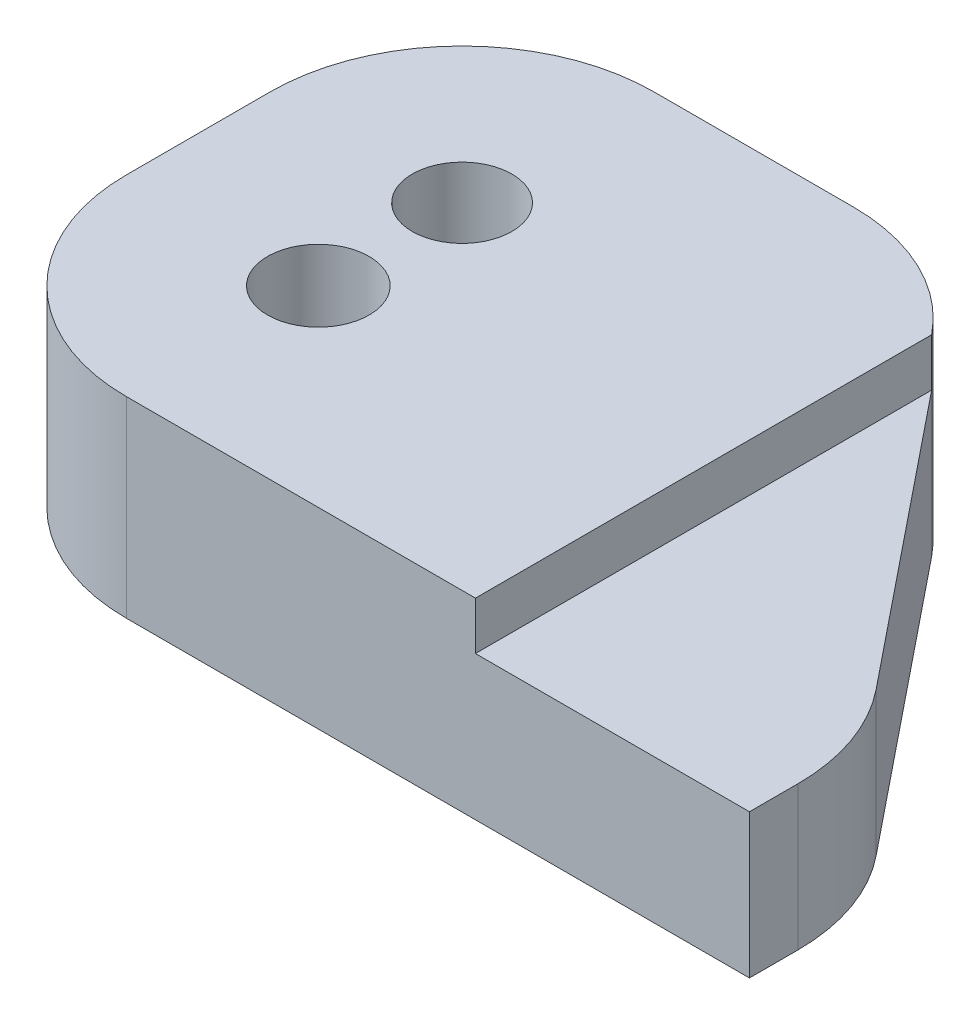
SolidWorks part; units mm, degrees
ref_plane "Front Plane" through (0, 0, 0) normal (0, 0, 1) x (1, 0, 0)
ref_plane "Top Plane" through (0, 0, 0) normal (0, 1, 0) x (1, 0, 0)
ref_plane "Right Plane" through (0, 0, 0) normal (1, 0, 0) x (0, 0, -1)
sketch "Sketch1" plane through (0, 0, 0) normal (0, 1, 0) x (1, 0, 0)
  line L0 (10.0403, 34.9076) -> (53.9179, -19.499)
  line L1 (-53.9179, -34.9076) -> (53.9179, -34.9076)
  line L2 (-53.9179, -34.9076) -> (-53.9179, 34.9076)
  line L3 (-53.9179, 34.9076) -> (10.0403, 34.9076)
  line L4 (53.9179, -34.9076) -> (53.9179, -19.499)
  line L5 (-53.9179, -34.9076) -> (53.9179, 34.9076) construction
  line L6 (-53.9179, 34.9076) -> (53.9179, -34.9076) construction
  line L7 (10.0403, 34.9076) -> (53.9179, 34.9076) construction
  line L8 (53.9179, 34.9076) -> (53.9179, -19.499) construction
  point P0 (0, 0)
extrude "Boss-Extrude1" add sketch "Sketch1" along normal blind 19.05
fillet "Fillet1" radius 25.4 4 edges at (-53.9179, 9.525, 34.9076) (-53.9179, 9.525, -34.9076) (10.0403, 9.525, -34.9076) (53.9179, 9.525, 19.499)
sketch "Sketch3" plane through (0, 19.05, 0) normal (0, 1, 0) x (1, 0, 0)
  line L0 (17.6653, 25.4528) -> (17.6653, -34.9076)
  line L5 (-53.9179, 9.5076) -> (-53.9179, -9.5076)
  line L6 (-28.5179, -34.9076) -> (53.9179, -34.9076)
  line L7 (53.9179, -34.9076) -> (53.9179, -28.4651)
  line L8 (48.2894, -12.5199) -> (17.6653, 25.4528)
  line L9 (-2.1061, 34.9076) -> (-28.5179, 34.9076)
  line L10 (-53.9179, 9.5076) -> (-53.9179, -9.5076)
  line L11 (-28.5179, -34.9076) -> (17.6653, -34.9076)
  line L14 (-2.1061, 34.9076) -> (-28.5179, 34.9076)
  arc A4 (-53.9179, -9.5076) -> (-28.5179, -34.9076) centre (-28.5179, -9.5076) ccw
  arc A5 (53.9179, -28.4651) -> (48.2894, -12.5199) centre (28.5179, -28.4651) ccw
  arc A6 (17.6653, 25.4528) -> (-2.1061, 34.9076) centre (-2.1061, 9.5076) ccw
  arc A7 (-28.5179, 34.9076) -> (-53.9179, 9.5076) centre (-28.5179, 9.5076) ccw
  arc A8 (-53.9179, -9.5076) -> (-28.5179, -34.9076) centre (-28.5179, -9.5076) ccw
  arc A10 (17.6653, 25.4528) -> (-2.1061, 34.9076) centre (-2.1061, 9.5076) ccw
  arc A11 (-28.5179, 34.9076) -> (-53.9179, 9.5076) centre (-28.5179, 9.5076) ccw
  point P14 (0, 0)
  dimension "D1" = 0
extrude "Boss-Extrude2" add sketch "Sketch3" along normal blind 6.35
sketch "Sketch4" plane through (0, 25.4, 0) normal (0, 1, 0) x (1, 0, 0)
  circle A0 centre (-28.5179, -9.5076) radius 6.7218
  circle A1 centre (-28.5179, 9.5076) radius 6.5909
extrude "Cut-Extrude3" cut sketch "Sketch4" against normal through all
